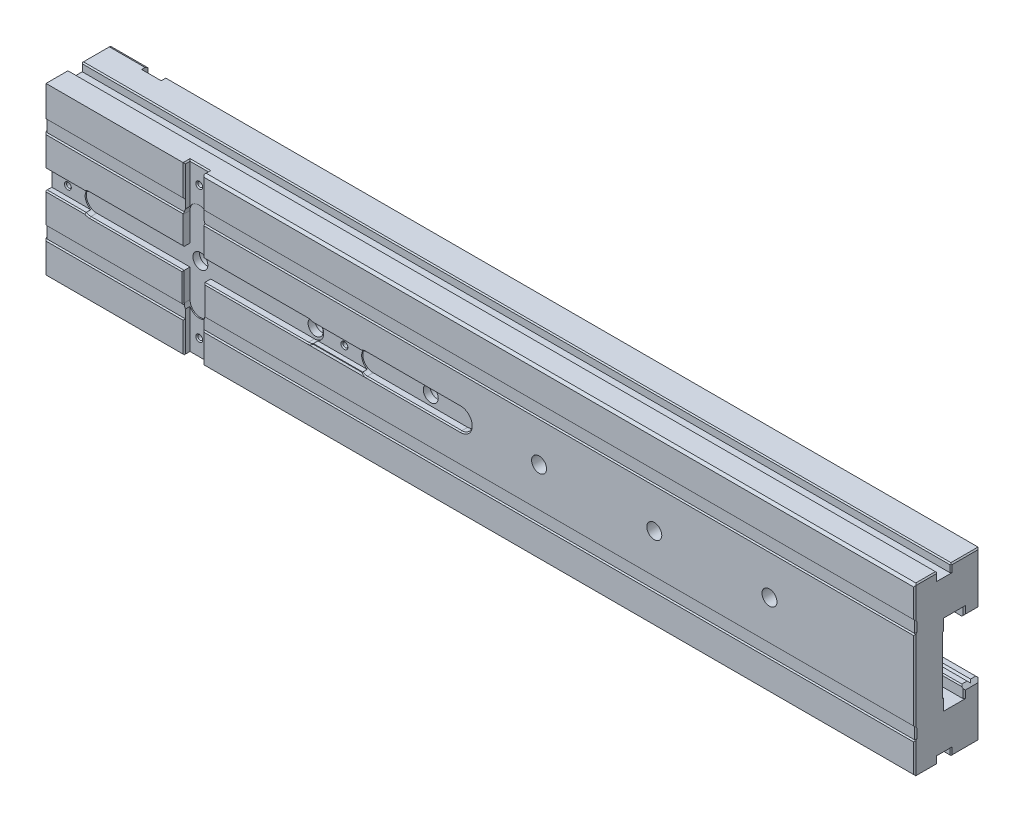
SolidWorks part; units mm, degrees
ref_plane "Front Plane" through (0, 0, 0) normal (0, 0, 1) x (1, 0, 0)
ref_plane "Top Plane" through (0, 0, 0) normal (0, 1, 0) x (1, 0, 0)
ref_plane "Right Plane" through (0, 0, 0) normal (1, 0, 0) x (0, 0, -1)
imported_body "Imported1"
sketch "Sketch1" plane through (0, 0, -24.2) normal (0, 0, -1) x (-1, 0, 0)
  circle A0 centre (348.5, 0) radius 10
  circle A1 centre (248.5, 0) radius 10
  circle A2 centre (148.5, 0) radius 10
extrude "Boss-Extrude1" add sketch "Sketch1" against normal up to surface (18.2 mm away)
sketch "Sketch2" plane through (0, 0, -24.2) normal (0, 0, -1) x (-1, 0, 0)
  circle A1 centre (48.5, 0) radius 10
  circle A2 centre (-51.5, 0) radius 10
  circle A3 centre (-151.5, 0) radius 10
extrude "Boss-Extrude2" add sketch "Sketch2" against normal up to surface (24.2 mm away)
hole_wizard "Hole1" positions "Sketch4" profile "Sketch3" legacy
sketch "Sketch4" plane through (0, 0, -24.2) normal (0, 0, -1) x (-1, 0, 0)
  line L0 (477.5, 25) -> (477.5, -25) construction
  point P0 (348.5, 0)
  point P2 (248.5, 0)
  point P4 (148.5, 0)
  point P10 (48.5, 0)
  point P12 (-51.5, 0)
  point P14 (-151.5, 0)
  dimension "D1" = 129
  dimension "D2" = 100
  dimension "D3" = 100
  dimension "D4" = 100
  dimension "D5" = 100
  dimension "D6" = 100
sketch "Sketch3" plane through (-348.5, 0, -24.2) normal (1, 0, 0) x (0, 1, 0)
  line L0 (0, 0) -> (0, 100)
  line L1 (0, 100) -> (6.5, 100)
  line L2 (6.5, 100) -> (6.5, 12.5)
  line L3 (6.5, 12.5) -> (9.5, 12.5)
  line L4 (9.5, 12.5) -> (9.5, 0)
  line L5 (9.5, 0) -> (0, 0)
  line L6 (0, 110) -> (0, -10) construction
  dimension "Diameter" = 13
  dimension "Depth" = 100
  dimension "C-Bore Diameter" = 19
  dimension "C-Bore Depth" = 12.5
